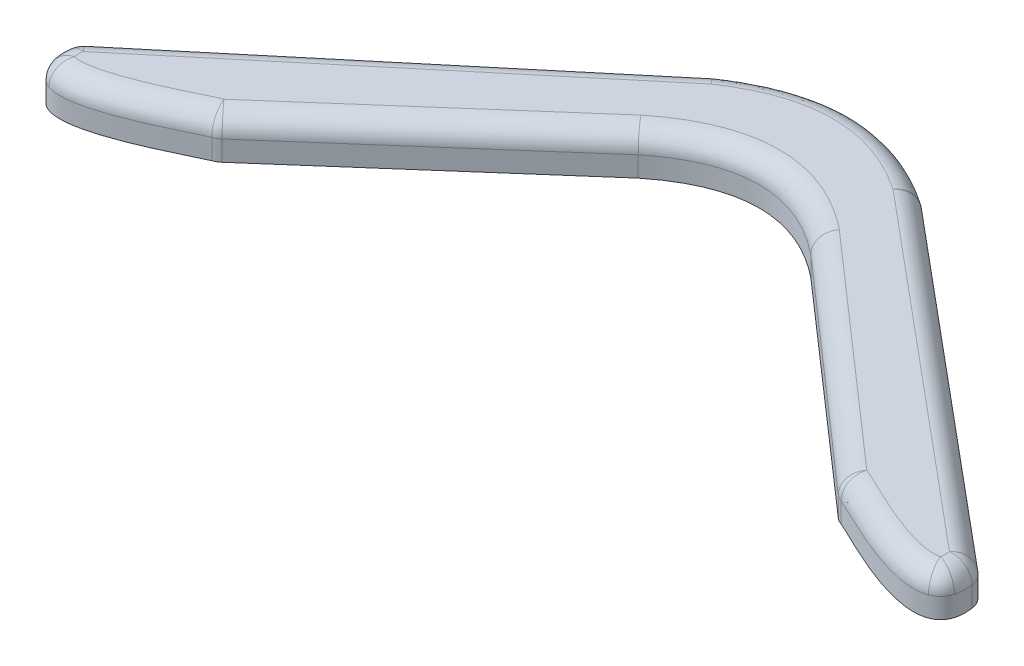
SolidWorks part; units mm, degrees
ref_plane "Front Plane" through (0, 0, 0) normal (0, 0, 1) x (1, 0, 0)
ref_plane "Top Plane" through (0, 0, 0) normal (0, 1, 0) x (1, 0, 0)
ref_plane "Right Plane" through (0, 0, 0) normal (1, 0, 0) x (0, 0, -1)
sketch "Sketch1" plane through (0, 0, 0) normal (0, 1, 0) x (1, 0, 0)
  line L0 (42.7337, -10.8901) -> (155.5521, -109.7436)
  line L1 (0, 10.0528) -> (0, -16.0279) construction
  line L2 (-42.7337, -10.8901) -> (-155.5521, -109.7436)
  line L3 (51.1557, 35.4217) -> (223.5837, -108.5798)
  line L4 (-51.1557, 35.4217) -> (-223.5837, -108.5798)
  spline S0 degree 2 poles (-42.7337, -10.8901) (0, 23.4056) (42.7337, -10.8901) knots 0 0 0 1 1 1
  spline S1 degree 3 poles (155.5521, -109.7436) (146.3144, -101.0793) (234.9236, -157.3795) (223.5837, -108.5798) knots 0 0 0 0 1 1 1 1
  spline S2 degree 3 poles (-155.5521, -109.7436) (-146.3144, -101.0793) (-234.9236, -157.3795) (-223.5837, -108.5798) knots 0 0 0 0 1 1 1 1
  spline S3 degree 2 poles (-51.1557, 35.4217) (0, 70.2546) (51.1557, 35.4217) knots 0 0 0 1 1 1
  point P17 (212.0745, -128.7165)
  dimension "D1" = 150
extrude "Boss-Extrude1" add sketch "Sketch1" along normal blind 20
fillet "Fillet4" radius 10 4 edges at (137.3697, 20, 36.579) (99.1429, 20, 60.3169) (-99.1429, 20, 60.3169)
fillet "Fillet5" radius 10 4 edges at (51.1557, 5, -35.4217) (48.3631, 12.6964, -37.2714) (-137.3697, 20, 36.579)
fillet "Fillet6" radius 10 8 edges at (155.5521, 5, 109.7436) (154.8756, 11.8891, 108.9114) (223.5837, 5, 108.5798) (224.4289, 17.3276, 113.4484) (-223.5837, 5, 108.5798) (-224.4651, 17.5553, 113.8093) (-155.5521, 5, 109.7436) (-155.0055, 12.5675, 108.8189)
